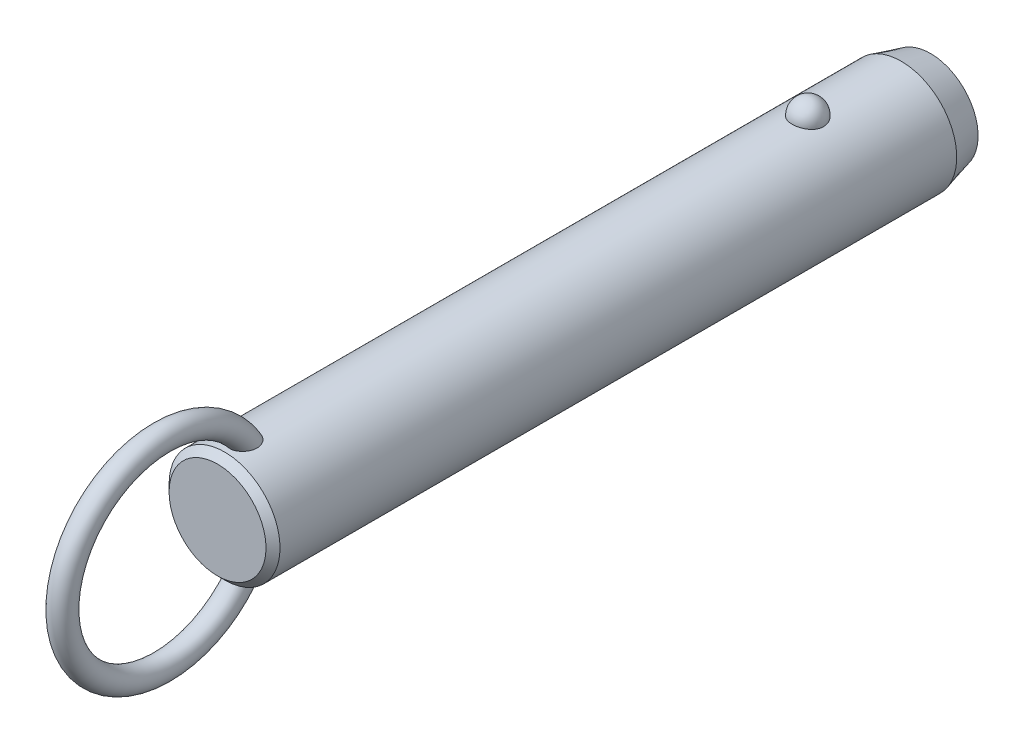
SolidWorks part; units mm, degrees
ref_plane "Front Plane" through (0, 0, 0) normal (0, 0, 1) x (1, 0, 0)
ref_plane "Top Plane" through (0, 0, 0) normal (0, 1, 0) x (1, 0, 0)
ref_plane "Right Plane" through (0, 0, 0) normal (1, 0, 0) x (0, 0, -1)
sketch "Sketch2" plane through (0, 0, 0) normal (0, 0, 1) x (1, 0, 0)
  circle A0 centre (0, 0) radius 9.5
  point P3 (0, 9.5)
  dimension "D1" = 19
extrude "Boss-Extrude1" add sketch "Sketch2" along normal blind 88.9
sketch "Sketch3" plane through (0, 0, 0) normal (0, 0, -1) x (-1, 0, 0)
  circle A0 centre (0, 0) radius 9.5
  dimension "D1" = 19
extrude "Boss-Extrude2" add sketch "Sketch3" along normal blind 23.7
chamfer "Chamfer1" distance 5 angle 15 1 edges at (-9.5, 0, -23.7)
sketch "Sketch12" plane through (0, 0, 0) normal (1, 0, 0) x (0, 0, -1)
  line L0 (-88.9, 9.5) -> (-88.9, -9.5) construction
  point P0 (-88.9, 0)
sketch "Sketch13" plane through (0, 0, 0) normal (1, 0, 0) x (0, 0, -1)
  circle A0 centre (-107.95, 0) radius 19.05
  point P2 (-88.9, 0)
  dimension "D1" = 38.1
sketch "Sketch14" plane through (0, 0, 0) normal (0, 1, 0) x (1, 0, 0)
  circle A0 centre (0, -90.9) radius 2
  point P2 (0, -88.9)
  dimension "D1" = 4
sweep "Sweep1" add profiles "Sketch14" path "Sketch13"
sketch "Sketch15" plane through (0, 0, 88.9) normal (0, 0, 1) x (1, 0, 0)
  circle A0 centre (0, 0) radius 9.5
  dimension "D1" = 19
extrude "Boss-Extrude3" add sketch "Sketch15" along normal blind 9.52
chamfer "Chamfer2" distance 1.2 angle 45 1 edges at (9.5, 0, 98.42)
sketch "Sketch18" plane through (0, 0, 0) normal (1, 0, 0) x (0, 0, -1)
  line L0 (18.7, 9.5) -> (-91.4378, 9.5) construction
  line L1 (2.7, 12.2) -> (2.7, 6.8)
  line L2 (-91.4378, -9.5) -> (18.7, -9.5) construction
  arc A0 (2.7, 12.2) -> (2.7, 6.8) centre (2.7, 9.5) ccw
  point P4 (0, 9.5)
  dimension "D1" = 21.7
revolve "Revolve1" add sketch "Sketch18" angle 360 about L1
